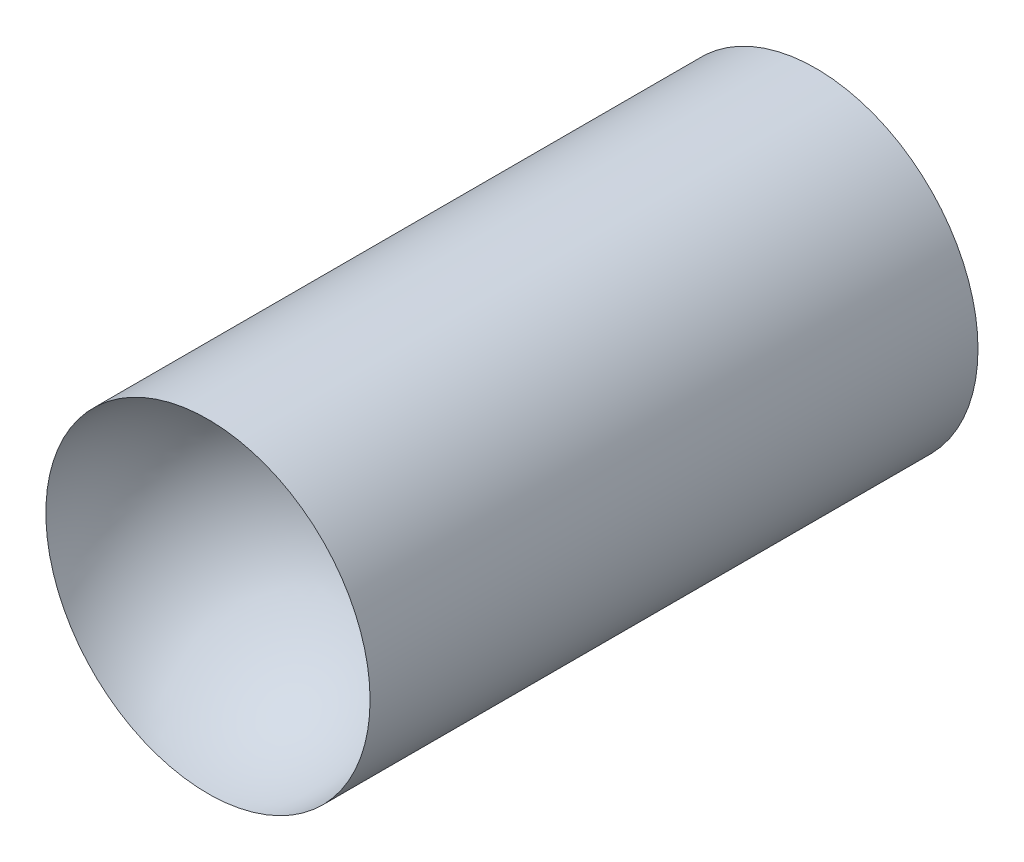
SolidWorks part; units mm, degrees
ref_plane "Plan de face" through (0, 0, 0) normal (0, 0, 1) x (1, 0, 0)
ref_plane "Plan de dessus" through (0, 0, 0) normal (0, 1, 0) x (1, 0, 0)
ref_plane "Plan de droite" through (0, 0, 0) normal (1, 0, 0) x (0, 0, -1)
sketch "Esquisse1" plane through (0, 0, 0) normal (0, 0, 1) x (1, 0, 0)
  circle A0 centre (0, 0) radius 4
  dimension "D1" = 8
extrude "Extrusion1" add sketch "Esquisse1" along normal blind 15
sketch "Esquisse3" plane through (0, 0, 0) normal (0, 1, 0) x (1, 0, 0)
  line L0 (-4, -15) -> (4, -15) construction
  line L1 (0, -15) -> (4, -15)
  line L2 (0, -17.4586) -> (0, 2.9348) construction
  line L3 (0, -15) -> (0, -11)
  arc A0 (4, -15) -> (0, -11) centre (0, -15) ccw
revolve "Enlèvement de matière-Révolution1" cut sketch "Esquisse3" angle 360 about L2
